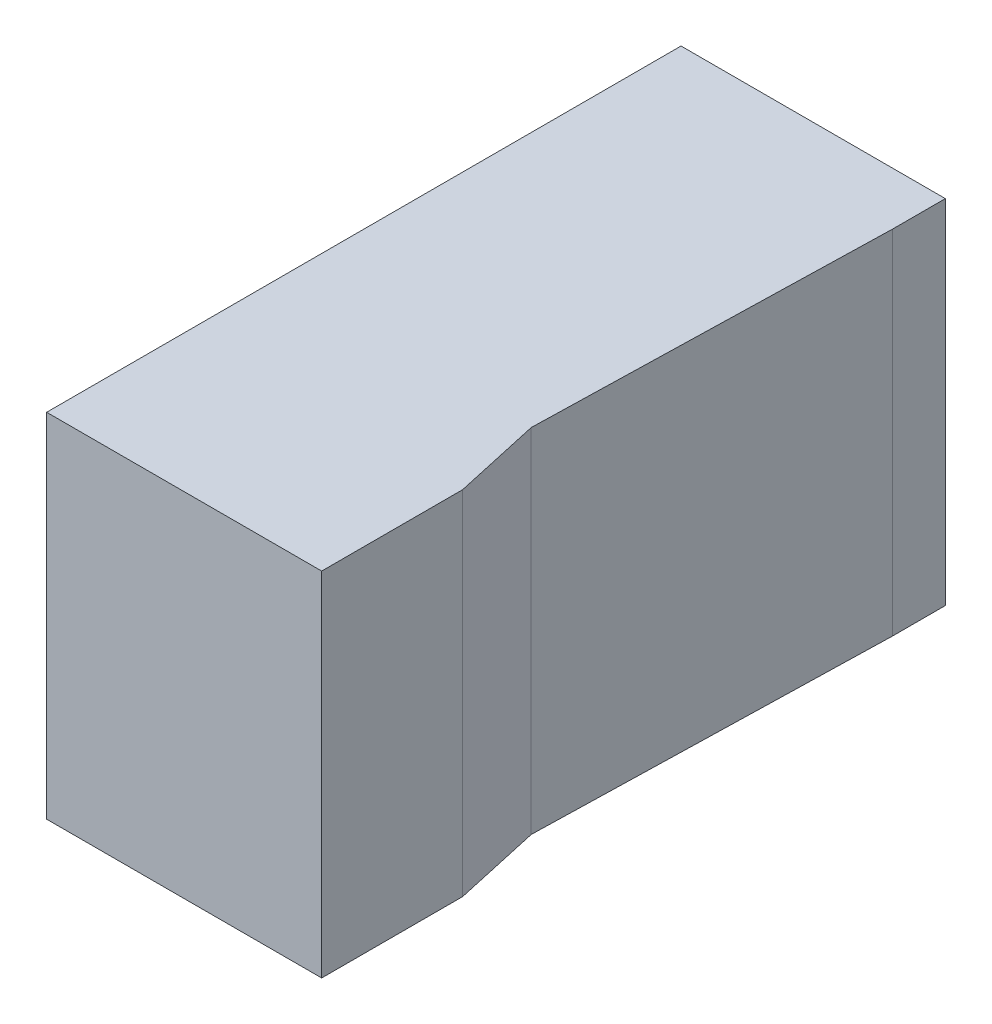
SolidWorks part; units mm, degrees
ref_plane "Ebene vorne" through (0, 0, 0) normal (0, 0, 1) x (1, 0, 0)
ref_plane "Ebene oben" through (0, 0, 0) normal (0, 1, 0) x (1, 0, 0)
ref_plane "Ebene rechts" through (0, 0, 0) normal (1, 0, 0) x (0, 0, -1)
sketch "hilfsskizze_hinterschnitt" plane through (0, 0, 0) normal (0, 1, 0) x (1, 0, 0)
  line L0 (0, 0) -> (0, 67.7219) construction
  line L1 (-20, 20) -> (-20, -8.1134) construction
  line L2 (-35.1539, 0) -> (-5.6255, 0) construction
  line L3 (-20, 20) -> (-20.5, 0)
  line L4 (-20, 20) -> (-20, 23)
  line L5 (-20, 23) -> (-35, 23)
  line L6 (-35, 23) -> (-35, -13)
  line L7 (-20.5, 0) -> (-19.3923, -5)
  line L8 (-19.3923, -5) -> (-19.3923, -13)
  line L9 (-19.3923, -13) -> (-35, -13)
  line L10 (-12.2305, 2.681) -> (-12.2305, 34.7166) construction
  line L11 (-16.2305, 17.6092) -> (-16.2305, 36.4813)
  line L12 (-8.2305, 17.6092) -> (-8.2305, 36.4813)
  line L13 (-8.2305, 36.4813) -> (-16.2305, 36.4813)
  line L14 (-49.0118, 2.681) -> (11.0731, 2.681) construction
  arc A0 (-16.2305, 17.6092) -> (-8.2305, 17.6092) centre (-12.2305, 10.681) ccw
  point P22 (-20.433, 2.681)
  dimension "D9" = 8
  dimension "D1" = 20
  dimension "D2" = 20
  dimension "D3" = 1
  dimension "D4" = 5
  dimension "D5" = 0.6077
  dimension "D6" = 15
  dimension "D7" = 8
  dimension "D8" = 3
  dimension "D10" = 8
  dimension "D11" = 8.2025
sketch "Skizze2" plane through (0, 0, 0) normal (0, 1, 0) x (1, 0, 0)
  line L0 (-20, 20) -> (-20, 23) construction
  line L1 (-20, 20) -> (-20.5, 0) construction
  line L2 (-20.5, 0) -> (-19.3923, -5) construction
  line L3 (-19.3923, -5) -> (-19.3923, -13) construction
  line L4 (-19.3923, -13) -> (-35, -13) construction
  line L5 (-35, 23) -> (-35, -13) construction
  line L6 (-20, 23) -> (-35, 23) construction
  line L7 (-20, 20) -> (-20, 23)
  line L8 (-20, 20) -> (-20.5, 0)
  line L9 (-20.5, 0) -> (-19.3923, -5)
  line L10 (-19.3923, -5) -> (-19.3923, -13)
  line L11 (-19.3923, -13) -> (-35, -13)
  line L12 (-35, 23) -> (-35, -13)
  line L13 (-20, 23) -> (-35, 23)
extrude "teil mit hinterschnitt" add sketch "Skizze2" along normal mid plane 20
sketch "Skizze zum verschieben die z schnitte" plane through (0, 10, 0) normal (0, 1, 0) x (1, 0, 0)
  line L3 (-16.1475, 20.9282) -> (-16.1475, 40.9282)
  line L4 (-8.1475, 40.9282) -> (-16.1475, 40.9282)
  line L5 (-8.1475, 20.9282) -> (-8.1475, 40.9282)
  line L7 (-12.1475, 6) -> (-12.1475, 66) construction
  line L9 (-55.9163, 6) -> (4.1686, 6) construction
  line L10 (-20.5, 0) -> (-20, 20) construction
  line L11 (-20.5, 0) -> (-20, 20) construction
  line L13 (-20, 20) -> (-20, -20.947) construction
  line L14 (-19.3923, -5) -> (-20.5, 0) construction
  arc A1 (-16.1475, 20.9282) -> (-8.1475, 20.9282) centre (-12.1475, 14) ccw
  point P11 (-20.35, 6)
  point P12 (-20, -2.2569)
  dimension "D2" = 8
  dimension "D1" = 8
  dimension "D3" = 20
  dimension "D4" = 60
  dimension "D5" = 8.2025
  dimension "D6" = 6
ref_plane "schnittebene" through (0, 0, -6) normal (0, 0, -1) x (-1, 0, 0)
sketch "bahn zum fräsen" plane through (0, 0, -6) normal (0, 0, -1) x (-1, 0, 0)
  line L0 (20.35, 10) -> (20.35, -10)
  line L1 (20.35, 10) -> (20.35, -10) construction
  line L2 (12.15, 10) -> (12.15, -10)
  dimension "D1" = 8.2
